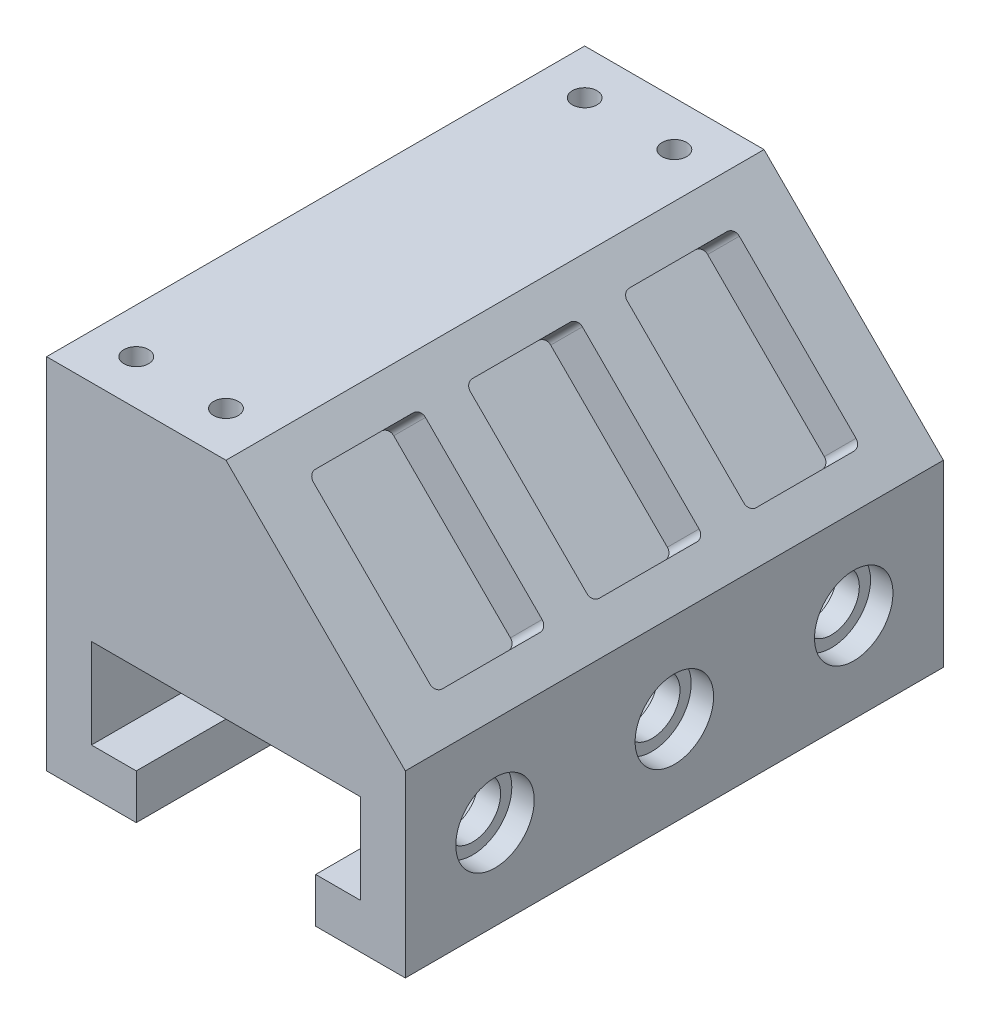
SolidWorks part; units mm, degrees
ref_plane "Front Plane" through (0, 0, 0) normal (0, 0, 1) x (1, 0, 0)
ref_plane "Top Plane" through (0, 0, 0) normal (0, 1, 0) x (1, 0, 0)
ref_plane "Right Plane" through (0, 0, 0) normal (1, 0, 0) x (0, 0, -1)
sketch "Sketch1"
  line L0 (0, 0) -> (0, 101.6)
  line L1 (0, 101.6) -> (50.8, 101.6)
  line L2 (50.8, 101.6) -> (101.6, 50.8)
  line L3 (101.6, 50.8) -> (101.6, 0)
  line L4 (101.6, 0) -> (76.2, 0)
  line L5 (76.2, 0) -> (76.2, 12.7)
  line L6 (76.2, 12.7) -> (88.9, 12.7)
  line L7 (88.9, 12.7) -> (88.9, 38.1)
  line L8 (88.9, 38.1) -> (12.7, 38.1)
  line L9 (12.7, 38.1) -> (12.7, 12.7)
  line L10 (12.7, 12.7) -> (25.4, 12.7)
  line L11 (25.4, 12.7) -> (25.4, 0)
  line L12 (25.4, 0) -> (0, 0)
other "AlignGroup1"
other "AlignGroup2" parameters "D1"=112.8237, "D2"=101.6, "D3"=50.8, "D4"=12.7, "D5"=25.4, "D6"=76.2, "D7"=88.9, "D8"=0, "D9"=12.7, "D10"=38.1, "D11"=50.8, "D12"=101.6
other "AlignGroup3"
extrude "Boss-Extrude1" add sketch "Sketch1" against normal blind 152.4
sketch "Sketch2" plane through (76.2, 76.2, 0) normal (0.7071, 0.7071, 0) x (0, 0, -1)
  line L0 (60.325, -23.368) -> (60.325, 23.368)
  line L1 (17.907, -25.4) -> (45.593, -25.4)
  line L2 (15.875, -23.368) -> (15.875, 23.368)
  line L3 (17.907, 25.4) -> (45.593, 25.4)
  line L4 (47.625, -23.368) -> (47.625, 23.368)
  line L5 (62.357, -25.4) -> (90.043, -25.4)
  line L6 (92.075, -23.368) -> (92.075, 23.368)
  line L7 (62.357, 25.4) -> (90.043, 25.4)
  line L8 (104.775, -23.368) -> (104.775, 23.368)
  line L9 (106.807, -25.4) -> (134.493, -25.4)
  line L10 (136.525, -23.368) -> (136.525, 23.368)
  line L11 (106.807, 25.4) -> (134.493, 25.4)
  line L12 (0, -35.921) -> (0, 35.921) construction
  line L13 (0, 0) -> (152.4, 0) construction
  arc A0 (136.525, 23.368) -> (134.493, 25.4) centre (134.493, 23.368) ccw
  arc A1 (134.493, -25.4) -> (136.525, -23.368) centre (134.493, -23.368) ccw
  arc A2 (104.775, -23.368) -> (106.807, -25.4) centre (106.807, -23.368) ccw
  arc A3 (104.775, 23.368) -> (106.807, 25.4) centre (106.807, 23.368) cw
  arc A4 (60.325, 23.368) -> (62.357, 25.4) centre (62.357, 23.368) cw
  arc A5 (92.075, 23.368) -> (90.043, 25.4) centre (90.043, 23.368) ccw
  arc A6 (90.043, -25.4) -> (92.075, -23.368) centre (90.043, -23.368) ccw
  arc A7 (60.325, -23.368) -> (62.357, -25.4) centre (62.357, -23.368) ccw
  arc A8 (17.907, -25.4) -> (15.875, -23.368) centre (17.907, -23.368) cw
  arc A9 (45.593, -25.4) -> (47.625, -23.368) centre (45.593, -23.368) ccw
  arc A10 (45.593, 25.4) -> (47.625, 23.368) centre (45.593, 23.368) cw
  arc A11 (15.875, 23.368) -> (17.907, 25.4) centre (17.907, 23.368) cw
  dimension "D6" = 2.032
  dimension "D2" = 15.875
  dimension "D3" = 12.7
  dimension "D4" = 31.75
  dimension "D5" = 25.4
  dimension "D1" = 3
extrude "Cut-Extrude1" cut sketch "Sketch2" against normal blind 12.7
hole_wizard "CBORE for 1/4 Binding Head Machine Screw1" positions "Sketch5" profile "Sketch4" counterbore size "1/4" standard "ANSI Inch"
sketch "Sketch5" plane through (101.6, 0, 0) normal (1, 0, 0) x (0, 0, -1)
  line L0 (152.4, 0) -> (0, 0) construction
  line L1 (0, 0) -> (0, 50.8) construction
  point P0 (25.4, 25.4)
  dimension "D1" = 25.4
  dimension "D2" = 25.4
sketch "Sketch4" plane through (101.6, 25.4, -25.4) normal (0, 1, 0) x (0, 0, -1)
  line L0 (0, 0) -> (0, 101.6)
  line L1 (0, 101.6) -> (7.9375, 101.6)
  line L3 (7.9375, 101.6) -> (7.9375, 6.35)
  line L4 (7.9375, 6.35) -> (11.1125, 6.35)
  line L5 (11.1125, 6.35) -> (11.1125, 0)
  line L7 (11.1125, 0) -> (0, 0)
  line L11 (0, -6.35) -> (0, 107.95) construction
  dimension "Thru Hole Dia." = 15.875
  dimension "Thru Hole Depth" = 101.6
  dimension "C'Bore Dia." = 22.225
  dimension "C'Bore Depth" = 6.35
pattern_linear "LPattern1" count 3 spacing 50.8 along (0, 0, -1) of "CBORE for 1/4 Binding Head Machine Screw1"
ref_plane "Plane1" through (50.8, 0, 0) normal (1, 0, 0) x (0, 0, -1)
mirror "Mirror1" about plane through (50.8, 0, 0) normal (1, 0, 0) of "LPattern1", "CBORE for 1/4 Binding Head Machine Screw1"
sketch "Sketch6" plane through (0, 101.6, 0) normal (0, 1, 0) x (1, 0, 0)
  line L0 (50.8, 0) -> (0, 0) construction
  line L2 (0, 152.4) -> (0, 0) construction
  circle A0 centre (12.7, 12.7) radius 3.4925
  circle A1 centre (38.1, 12.7) radius 3.4925
  circle A2 centre (38.1, 139.7) radius 3.4925
  circle A3 centre (12.7, 139.7) radius 3.4925
  dimension "D5" = 6.985
  dimension "D1" = 12.7
  dimension "D2" = 12.7
  dimension "D3" = 127
  dimension "D4" = 25.4
extrude "Cut-Extrude2" cut sketch "Sketch6" against normal blind 25.4
sketch "Sketch7" [suppressed] plane through (0, 101.6, 0) normal (0, 1, 0) x (1, 0, 0)
  line L0 (101.6, 0) -> (50.8, 0) construction
  line L1 (107.95, 76.2) -> (38.1, 76.2)
  line L2 (107.95, 76.2) -> (107.95, -6.35)
  line L3 (107.95, -6.35) -> (38.1, -6.35)
  line L4 (38.1, 76.2) -> (38.1, -6.35)
  line L5 (0, 152.4) -> (0, 0) construction
  dimension "D1" = 6.35
  dimension "D2" = 38.1
  dimension "D3" = 82.55
  dimension "D4" = 69.85
extrude "Cut-Extrude3" [suppressed] cut sketch "Sketch7" against normal through all
